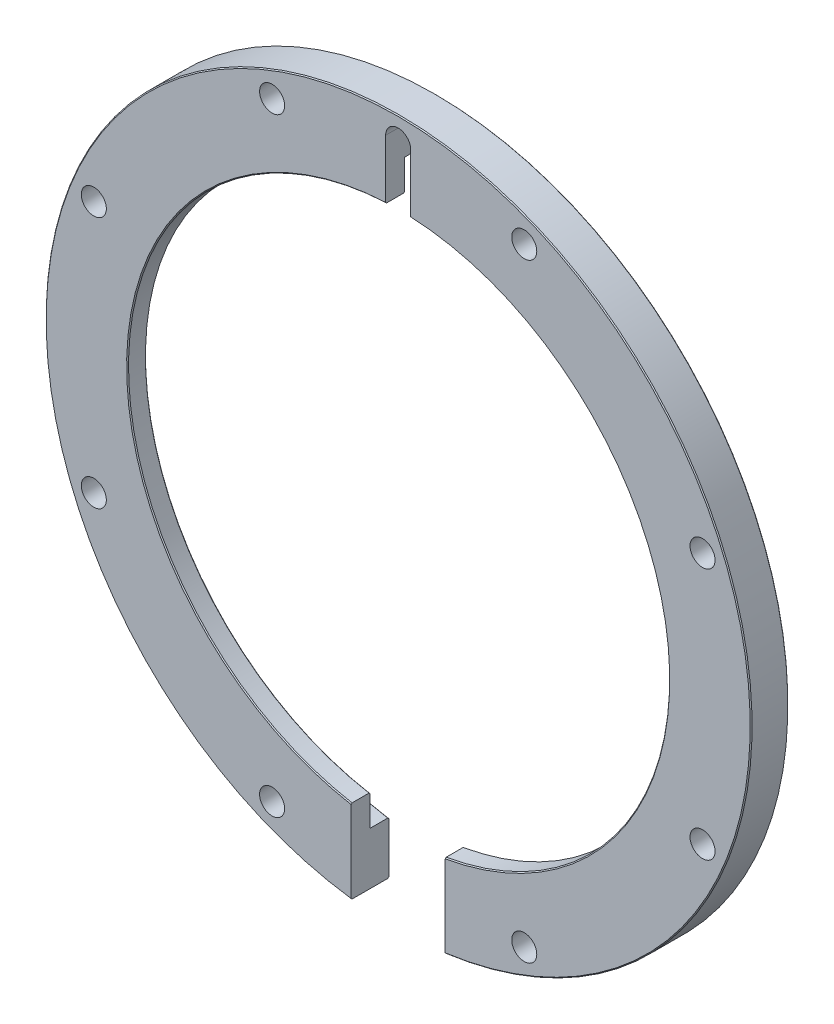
SolidWorks part; units mm, degrees
ref_plane "Front Plane" through (0, 0, 0) normal (0, 0, 1) x (1, 0, 0)
ref_plane "Top Plane" through (0, 0, 0) normal (0, 1, 0) x (1, 0, 0)
ref_plane "Right Plane" through (0, 0, 0) normal (1, 0, 0) x (0, 0, -1)
sketch "Sketch1" plane through (0, 0, 0) normal (0, 0, 1) x (1, 0, 0)
  circle A0 centre (-101.6, -107.95) radius 95.25
  circle A1 centre (-101.6, -107.95) radius 81.28
  dimension "D1" = 162.56
  dimension "D2" = 190.5
extrude "base ring" add sketch "Sketch1" along normal blind 5.08
sketch "Sketch2" plane through (0, 0, 5.08) normal (0, 0, 1) x (1, 0, 0)
  circle A0 centre (-101.6, -107.95) radius 95.25 construction
  circle A1 centre (-101.6, -107.95) radius 95.25
  circle A2 centre (-101.6, -107.95) radius 73.025
  dimension "D1" = 146.05
extrude "tab" add sketch "Sketch2" along normal blind 5.08
sketch "Sketch3" plane through (0, 0, 10.16) normal (0, 0, 1) x (1, 0, 0)
  circle A8 centre (-67.5794, -190.0829) radius 3.3782
  circle A9 centre (-19.4671, -141.9706) radius 3.3782
  circle A10 centre (-19.4671, -73.9294) radius 3.3782
  circle A11 centre (-67.5794, -25.8171) radius 3.3782
  circle A12 centre (-135.6206, -25.8171) radius 3.3782
  circle A13 centre (-183.7329, -73.9294) radius 3.3782
  circle A14 centre (-135.6206, -190.0829) radius 3.3782
  circle A15 centre (-183.7329, -141.9706) radius 3.3782
  dimension "D1" = 6.7564
  dimension "D2" = 6.7564
  dimension "D3" = 6.7564
  dimension "D4" = 6.7564
  dimension "D5" = 6.7564
  dimension "D6" = 6.7564
  dimension "D7" = 6.7564
  dimension "D8" = 6.7564
extrude "mounting holes" cut sketch "Sketch3" against normal through all
sketch "Sketch4" plane through (0, 0, 10.16) normal (0, 0, 1) x (1, 0, 0)
  line L0 (-101.6, -107.95) -> (-101.6, -215.5125) construction
  line L1 (-88.9, -210.1549) -> (-114.3, -210.1549)
  line L2 (-88.9, -210.1549) -> (-88.9, -179.8622)
  line L3 (-88.9, -179.8622) -> (-114.3, -179.8622)
  line L4 (-114.3, -210.1549) -> (-114.3, -179.8622)
  circle A2 centre (-101.6, -107.95) radius 73.025 construction
  dimension "D1" = 12.7
  dimension "D2" = 25.4
  dimension "D3" = 30.2927
extrude "gap" cut sketch "Sketch4" against normal through all
chamfer "Chamfer1" distance 0.254 angle 45 5 edges at (-101.6, -34.925, 5.08) (-101.6, -26.67, 0) (-101.6, -12.7, 0) (-101.6, -34.925, 10.16) (-101.6, -12.7, 10.16)
sketch "Sketch5" plane through (0, 0, 10.16) normal (0, 0, 1) x (1, 0, 0)
  line L0 (-101.6, -107.95) -> (-101.6, -7.1769) construction
  line L1 (-104.9782, -19.05) -> (-104.9782, -35.0032)
  line L2 (-98.2218, -19.05) -> (-98.2218, -35.0032)
  arc A0 (-98.2218, -19.05) -> (-104.9782, -19.05) centre (-101.6, -19.05) ccw
  arc A1 (-88.9, -179.8622) -> (-114.3, -179.8622) centre (-101.6, -107.95) ccw construction
  arc A2 (-98.2218, -35.0032) -> (-104.9782, -35.0032) centre (-101.6, -107.95) ccw
  dimension "D1" = 6.7564
  dimension "D2" = 88.9
extrude "flex cut" cut sketch "Sketch5" against normal through all
